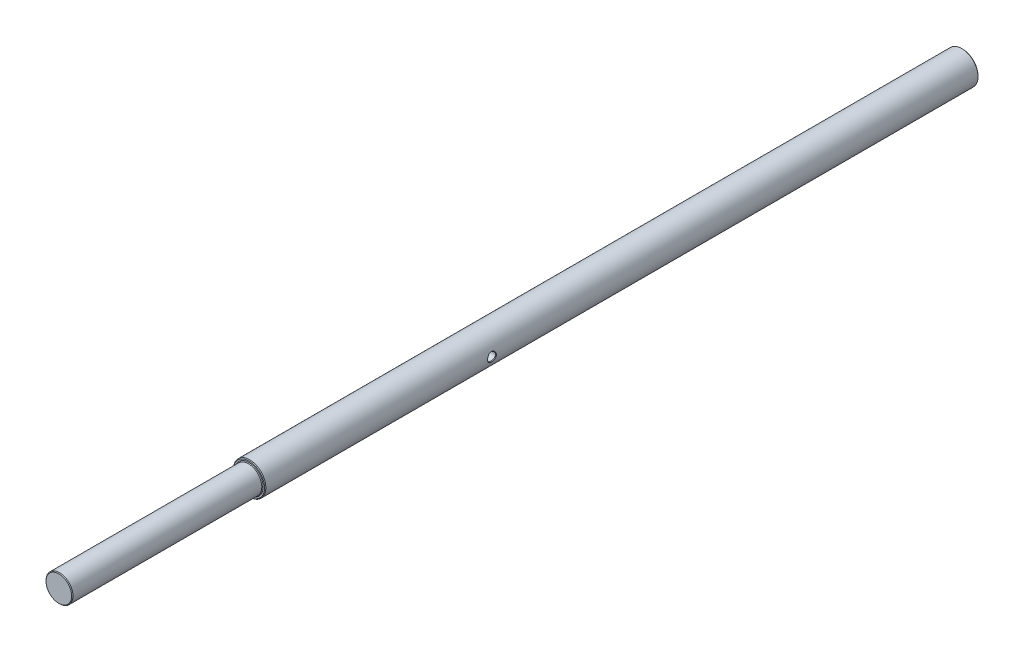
SolidWorks part; units mm, degrees
ref_plane "Спереди" through (0, 0, 0) normal (0, 0, 1) x (1, 0, 0)
ref_plane "Сверху" through (0, 0, 0) normal (0, 1, 0) x (1, 0, 0)
ref_plane "Справа" through (0, 0, 0) normal (1, 0, 0) x (0, 0, -1)
sketch "Эскиз1" plane through (0, 0, 0) normal (0, 0, 1) x (1, 0, 0)
  circle A0 centre (0, 0) radius 5
  dimension "D1" = 10
extrude "Бобышка-Вытянуть1" add sketch "Эскиз1" along normal blind 70.5
sketch "Эскиз2" plane through (0, 0, 0) normal (0, 0, -1) x (-1, 0, 0)
  circle A0 centre (0, 0) radius 6
  dimension "D1" = 12
extrude "Бобышка-Вытянуть2" add sketch "Эскиз2" along normal blind 264.5
sketch "Эскиз3" plane through (0, 0, 0) normal (1, 0, 0) x (0, 0, -1)
  line L0 (264.5, -6) -> (264.5, 6) construction
  circle A0 centre (84.09, 0) radius 1.5
  dimension "D1" = 3
  dimension "D2" = 180.41
extrude "Вырез-Вытянуть1" cut sketch "Эскиз3" against normal mid plane 20
chamfer "Фаска1" distance 0.25 angle 45 6 edges at (-6, 0, 0) (-6, 0, -264.5) (5.9928, 0.2934, -82.619) (-5.9928, -0.2934, -82.619) (-5, 0, 0) (5, 0, 70.5)
